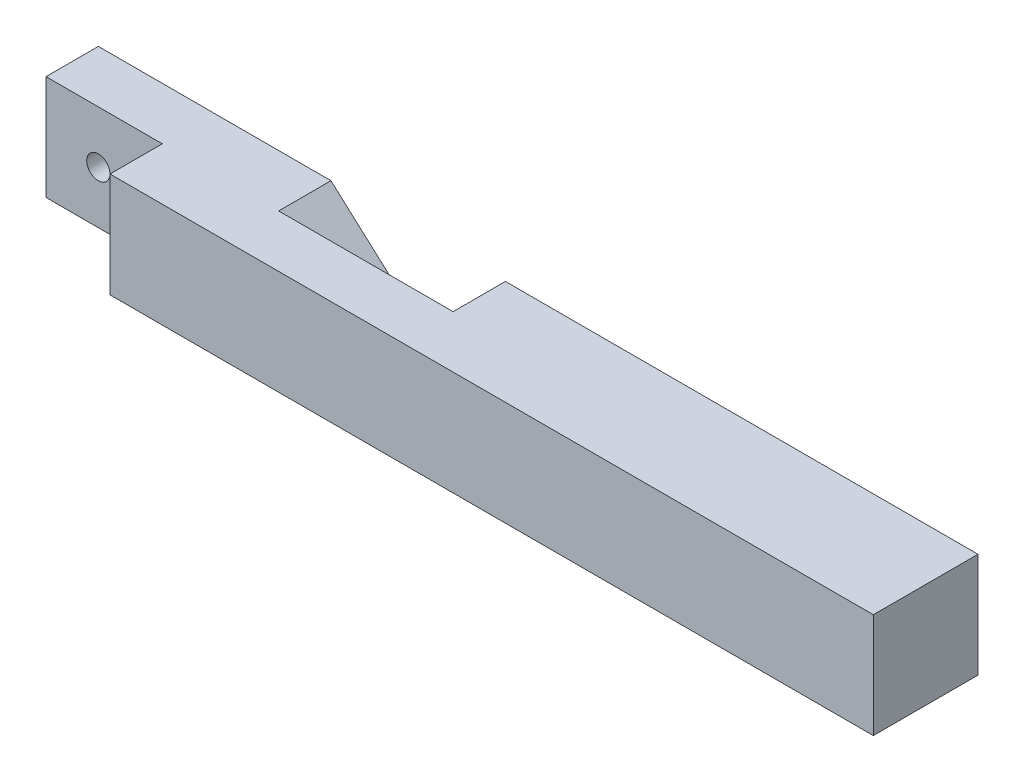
SolidWorks part; units mm, degrees
ref_plane "Plan de face" through (0, 0, 0) normal (0, 0, 1) x (1, 0, 0)
ref_plane "Plan de dessus" through (0, 0, 0) normal (0, 1, 0) x (1, 0, 0)
ref_plane "Plan de droite" through (0, 0, 0) normal (1, 0, 0) x (0, 0, -1)
sketch "Esquisse1" plane through (0, 0, 0) normal (0, 0, 1) x (1, 0, 0)
  line L1 (0, 0) -> (75.63, 0)
  line L2 (0, 0) -> (0, 9)
  line L3 (0, 9) -> (75.63, 9)
  line L4 (75.63, 0) -> (75.63, 9)
  dimension "D1" = 75.63
  dimension "D2" = 9
extrude "Extrusion1" add sketch "Esquisse1" along normal blind 9
sketch "Esquisse2" plane through (0, 0, 9) normal (0, 0, 1) x (1, 0, 0)
  line L0 (0, 0) -> (75.63, 0) construction
  line L1 (0, 9) -> (10, 9)
  line L2 (0, 9) -> (0, 0)
  line L3 (0, 0) -> (10, 0)
  line L4 (10, 9) -> (10, 0)
  dimension "D1" = 10
extrude "Enlèv. mat.-Extru.1" cut sketch "Esquisse2" against normal blind 4.5
sketch "Esquisse3" plane through (0, 0, 4.5) normal (0, 0, 1) x (1, 0, 0)
  line L0 (0, 9) -> (0, 0) construction
  line L1 (0, 0) -> (10, 0) construction
  circle A0 centre (4.5, 4.5) radius 1
  dimension "D3" = 2
  dimension "D1" = 4.5
  dimension "D2" = 4.5
extrude "Enlèv. mat.-Extru.2" cut sketch "Esquisse3" against normal blind 4.5
sketch "Esquisse4" plane through (0, 0, 0) normal (0, 0, -1) x (-1, 0, 0)
  line L0 (0, 4.5) -> (-25, 4.5) construction
  line L1 (0, 9) -> (0, 0) construction
  line L2 (-25, 4.5) -> (-34.8415, -8.0225) construction
  line L3 (-20, 9) -> (-25, 4.5)
  line L4 (-75.63, 9) -> (0, 9) construction
  line L5 (-25, 4.5) -> (-20, 0)
  line L6 (0, 0) -> (-75.63, 0) construction
  line L7 (-20, 0) -> (-35, 0)
  line L8 (-35, 0) -> (-40, 4.5)
  line L9 (-40, 4.5) -> (-35, 9)
  line L10 (-35, 9) -> (-20, 9)
  dimension "D1" = 15
  dimension "D2" = 15
  dimension "D3" = 20
  dimension "D4" = 20
  dimension "D5" = 25
extrude "Enlèv. mat.-Extru.3" cut sketch "Esquisse4" against normal blind 4.5
